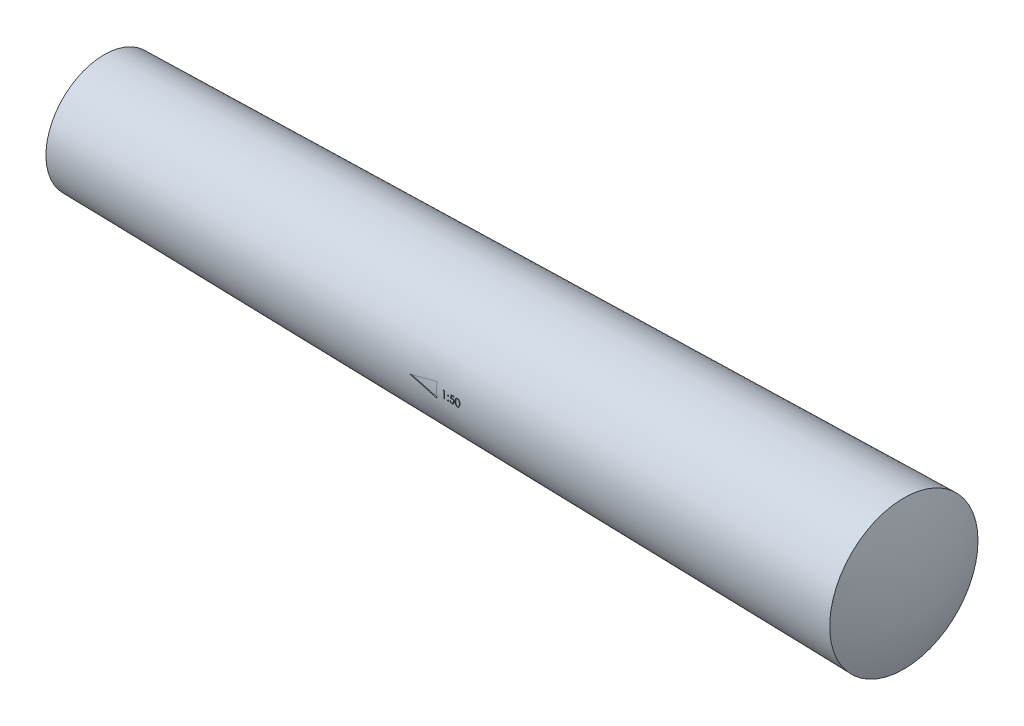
SolidWorks part; units mm, degrees
ref_plane "Front Plane" through (0, 0, 0) normal (0, 0, 1) x (1, 0, 0)
ref_plane "Top Plane" through (0, 0, 0) normal (0, 1, 0) x (1, 0, 0)
ref_plane "Right Plane" through (0, 0, 0) normal (1, 0, 0) x (0, 0, -1)
sketch "Sketch1" plane through (0, 0, 0) normal (1, 0, 0) x (0, 0, -1)
  circle A0 centre (0, 0) radius 8
  dimension "D1" = 16
extrude "Extrude1" add sketch "Sketch1" along normal mid plane 110
draft "Draft1" type of draft neutral plane draft angle 1.146 faces to draft 1 parameters "D1"=1.146
sketch "Sketch2" plane through (0, 0, 0) normal (0, 0, 1) x (1, 0, 0)
  line L0 (-55, 0) -> (-55, 8)
  line L1 (-55, 8) -> (-55, -8) construction
  line L2 (-55, 0) -> (-57, 0)
  line L3 (-57, 0) -> (-57, -9.1) construction
  line L4 (55, 0) -> (55, 10.2001)
  line L5 (55, -10.2001) -> (55, 10.2001) construction
  line L6 (55, 0) -> (57, 0)
  line L7 (57, 0) -> (57, -9.1) construction
  line L8 (-55, -8) -> (55, -10.2001) construction
  arc A0 (-57, 0) -> (-55, 8) centre (-40, 0) cw
  arc A1 (57, 0) -> (55, 10.2001) centre (29.9896, 0) ccw
  point P14 (0, -9.1)
revolve "Revolve1" add sketch "Sketch2" angle 360 about L2
sketch "Sketch5" plane through (0, 0, 0) normal (0, 0, 1) x (1, 0, 0)
  line L0 (0, 9.1) -> (0, -9.1) construction
  line L1 (55, 10.2001) -> (-55, 8) construction
  line L2 (-55, -8) -> (55, -10.2001) construction
ref_plane "Plane2" through (0, 0, 0) normal (-0.02, 0, 0.9998) x (0.9998, 0, 0.02)
sketch "Sketch6" plane through (0, 0, 0) normal (-0.02, 0, 0.9998) x (0.9998, 0, 0.02)
  line L0 (0, 0) -> (0, 1)
  line L1 (0, 9.1) -> (0, -9.1) construction
  line L2 (0, 1) -> (-3.7321, 0)
  line L3 (-3.7321, 0) -> (0, -1)
  line L4 (0, -1) -> (0, 0)
  line L5 (0, -0.5) -> (4, -0.5) construction
  text T0 "1:50" font "Century Gothic" height 1
  dimension "D1" = 2
  dimension "D2" = 30
  dimension "D3" = 4
wrap "Wrap2" sketch "Sketch6" wrap type deboss source sketch "Sketch6" thickness 0.1 parameters "D1"=0.1
equation "\"D2@Sketch2\" = \"D1@Sketch2\""
